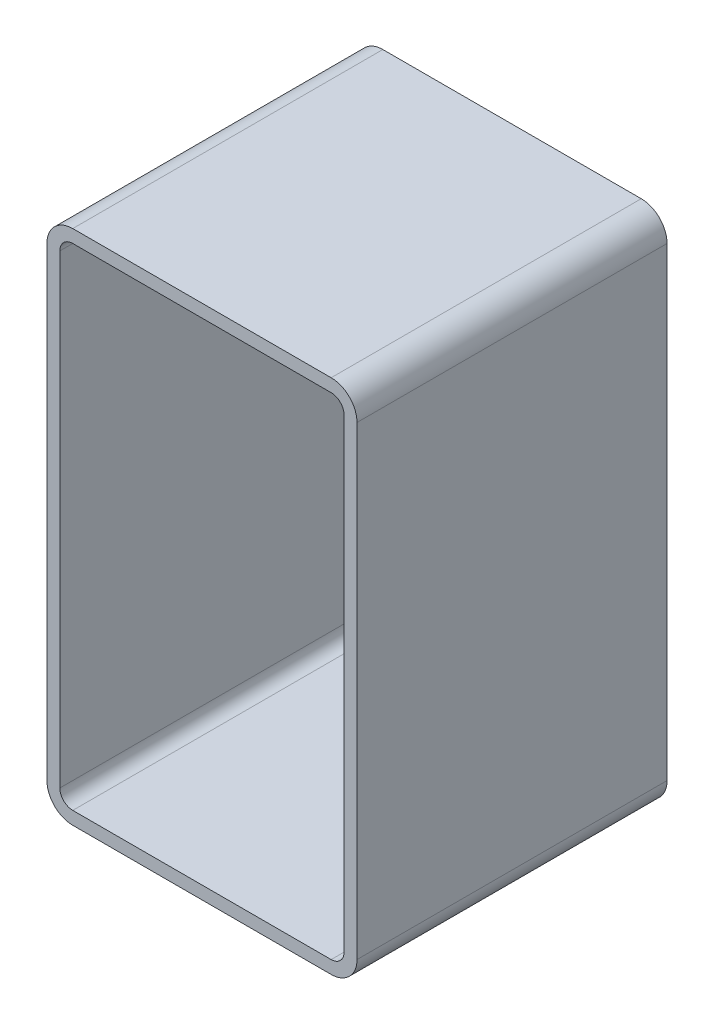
SolidWorks part; units mm, degrees
ref_plane "Front Plane" through (0, 0, 0) normal (0, 0, 1) x (1, 0, 0)
ref_plane "Top Plane" through (0, 0, 0) normal (0, 1, 0) x (1, 0, 0)
ref_plane "Right Plane" through (0, 0, 0) normal (1, 0, 0) x (0, 0, -1)
sketch "Sketch1" plane through (0, 0, 0) normal (0, 0, 1) x (1, 0, 0)
sketch_block_instance "HSS20x12x0.500-1"
sketch_block "HSS20x12x0.500"
extrude "Boss-Extrude1" add sketch "Sketch1" along normal blind 304.8
